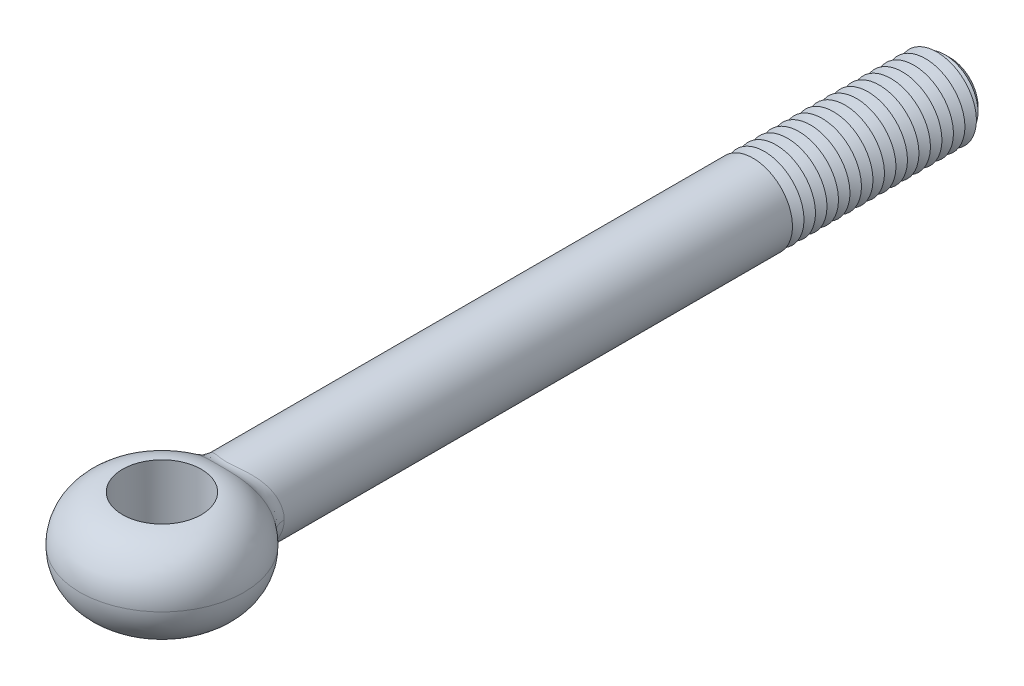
SolidWorks part; units mm, degrees
ref_plane "Front Plane" through (0, 0, 0) normal (0, 0, 1) x (1, 0, 0)
ref_plane "Top Plane" through (0, 0, 0) normal (0, 1, 0) x (1, 0, 0)
ref_plane "Right Plane" through (0, 0, 0) normal (1, 0, 0) x (0, 0, -1)
sketch "Sketch7" plane through (0, 0, 0) normal (0, 1, 0) x (1, 0, 0)
  circle A0 centre (0, 0) radius 12.5
  dimension "D1" = 25
extrude "Boss-Extrude3" add sketch "Sketch7" along normal mid plane 14
sketch "Sketch8" plane through (0, 0, 0) normal (0, 0, 1) x (1, 0, 0)
  circle A0 centre (0, 0) radius 6
  dimension "D1" = 12
extrude "Boss-Extrude4" add sketch "Sketch8" against normal blind 120
fillet "Fillet5" radius 7 2 edges at (0, -7, 12.5) (0, 7, 12.5)
fillet "Fillet6" radius 3 2 edges at (0.1735, -5.9975, -9.1081) (-0.1735, 5.9975, -9.1081)
chamfer "Chamfer1" distance 1.75 angle 45 1 edges at (6, 0, -120)
sketch "Sketch10" plane through (0, 0, 0) normal (0, 1, 0) x (1, 0, 0)
  line L0 (0, 28.1405) -> (0, -7.9233) construction
sketch "Sketch11" plane through (0, 0, 0) normal (0, 1, 0) x (1, 0, 0)
  line L0 (-6, 90) -> (-4.4845, 90.875)
  line L1 (-6, 118.25) -> (-6, 12.6194) construction
  line L2 (-4.4845, 90.875) -> (-6, 91.75)
  line L3 (-6, 91.75) -> (-6, 90)
  line L4 (4.25, 120) -> (-4.25, 120) construction
  dimension "D1" = 1.75
  dimension "D2" = 30
revolve "Cut-Revolve1" cut sketch "Sketch11" angle 360 about L0
pattern_linear "LPattern1" count 17 spacing 1.75 along (0, 0, -1) of "Cut-Revolve1"
sketch "Sketch12" plane through (0, 0, 0) normal (0, 1, 0) x (1, 0, 0)
  circle A0 centre (0, 0) radius 6
  dimension "D1" = 12
extrude "Cut-Extrude1" cut sketch "Sketch12" against normal mid plane 14
